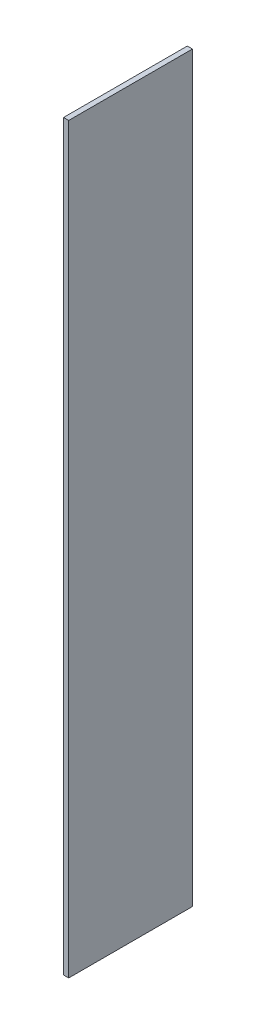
SolidWorks part; units mm, degrees
ref_plane "Front Plane" through (0, 0, 0) normal (0, 0, 1) x (1, 0, 0)
ref_plane "Top Plane" through (0, 0, 0) normal (0, 1, 0) x (1, 0, 0)
ref_plane "Right Plane" through (0, 0, 0) normal (1, 0, 0) x (0, 0, -1)
sketch "Sketch1" plane through (0, 0, 0) normal (0, 0, 1) x (1, 0, 0)
  line L1 (0, 0) -> (6.35, 0)
  line L2 (0, 0) -> (0, 914.4)
  line L3 (0, 914.4) -> (6.35, 914.4)
  line L4 (6.35, 0) -> (6.35, 914.4)
  dimension "D1" = 914.4
  dimension "D2" = 6.35
extrude "Boss-Extrude1" add sketch "Sketch1" along normal blind 152.4
